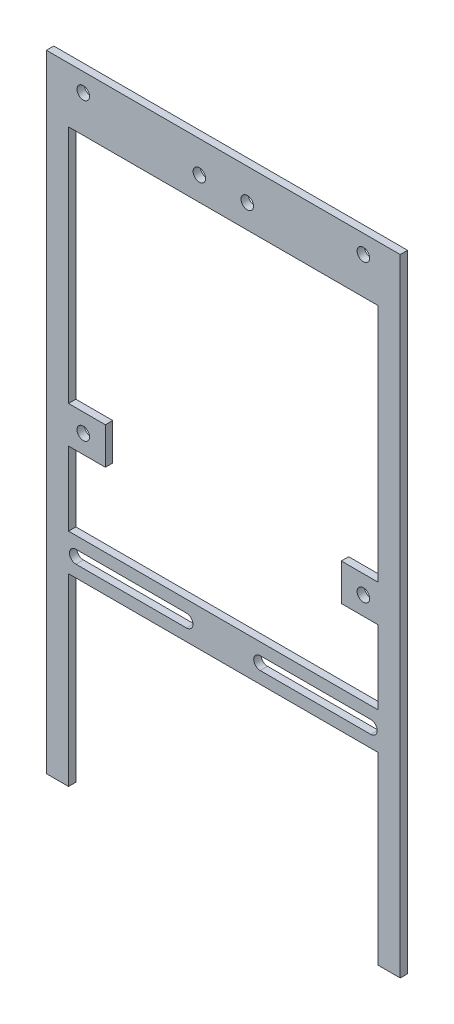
SolidWorks part; units mm, degrees
ref_plane "前视基准面" through (0, 0, 0) normal (0, 0, 1) x (1, 0, 0)
ref_plane "上视基准面" through (0, 0, 0) normal (0, 1, 0) x (1, 0, 0)
ref_plane "右视基准面" through (0, 0, 0) normal (1, 0, 0) x (0, 0, -1)
sketch "草图1" plane through (0, 0, 0) normal (0, 0, 1) x (1, 0, 0)
  line L1 (-47, 85) -> (47, 85)
  line L2 (-47, 85) -> (-47, -85)
  line L3 (-47, -85) -> (47, -85)
  line L4 (47, 85) -> (47, -85)
  line L5 (-47, 85) -> (47, -85) construction
  line L6 (-47, -85) -> (47, 85) construction
  point P0 (0, 0)
  dimension "D1" = 94
  dimension "D2" = 170
extrude "凸台-拉伸1" add sketch "草图1" along normal blind 2
hole_wizard "Ø3.4 (3.4) 直径孔1" positions "草图2" profile "草图3" hole size "Ø3.4" standard "GB"
sketch "草图2" plane through (0, 0, 2) normal (0, 0, 1) x (1, 0, 0)
  point P0 (-6.5, 76.4436)
  point P3 (6.5, 76.4436)
sketch "草图3" plane through (-6.5, 76.4436, 2) normal (1, 0, 0) x (0, -1, 0)
  line L0 (0, 0) -> (0, 2)
  line L1 (0, 2) -> (1.7, 2)
  line L2 (1.7, 2) -> (1.7, 0)
  line L5 (1.7, 0) -> (0, 0)
  line L11 (0, -6.35) -> (0, 107.95) construction
  dimension "通孔孔直径" = 3.4
  dimension "通孔孔深度" = 2
hole_wizard "Ø3.4 (3.4) 直径孔2" positions "草图4" profile "草图5" hole size "Ø3.4" standard "GB"
sketch "草图4" plane through (0, 0, 2) normal (0, 0, 1) x (1, 0, 0)
  point P0 (-38, 80)
  point P3 (38, 80)
  point P7 (-38, 0)
  point P10 (38, 0)
sketch "草图5" plane through (-38, 80, 2) normal (1, 0, 0) x (0, -1, 0)
  line L0 (0, 0) -> (0, 2)
  line L1 (0, 2) -> (1.7, 2)
  line L2 (1.7, 2) -> (1.7, 0)
  line L5 (1.7, 0) -> (0, 0)
  line L11 (0, -6.35) -> (0, 107.95) construction
  dimension "通孔孔直径" = 3.4
  dimension "通孔孔深度" = 2
sketch "草图6" plane through (0, 0, 2) normal (0, 0, 1) x (1, 0, 0)
  line L0 (-47, -85) -> (47, -85) construction
  line L1 (-32, -85) -> (32, -85)
  line L2 (32, 5) -> (42, 5)
  line L3 (-42, -5) -> (-32, -5)
  line L4 (-42, -5) -> (-42, -25)
  line L5 (47, 85) -> (-47, 85) construction
  line L6 (-32, 70) -> (32, 70)
  line L7 (-32, 5) -> (-32, -5)
  line L9 (32, 5) -> (32, -5)
  line L10 (47, -85) -> (47, 85) construction
  line L11 (-47, 85) -> (-47, -85) construction
  line L12 (-42, -25) -> (42, -25)
  line L13 (42, -5) -> (42, -25)
  line L14 (-42, -85) -> (42, -85)
  line L15 (-42, -35) -> (42, -35)
  line L16 (-42, -35) -> (-42, -85)
  line L17 (-42, -85) -> (42, -85)
  line L18 (42, -35) -> (42, -85)
  line L19 (-42, -72.1814) -> (-47, -72.1814)
  line L20 (-42, -72.1814) -> (-42, -73.2865)
  line L21 (-42, -73.2865) -> (-47, -73.2865)
  line L22 (-47, -72.1814) -> (-47, -73.2865)
  line L23 (-42, 70) -> (42, 70)
  line L24 (-42, 70) -> (-42, 5)
  line L25 (-42, 5) -> (-32, 5)
  line L26 (42, 70) -> (42, 5)
  line L27 (32, -5) -> (42, -5)
  dimension "D1" = 15
  dimension "D2" = 15
  dimension "D3" = 15
  dimension "D4" = 20
  dimension "D5" = 5
  dimension "D6" = 5
  dimension "D8" = 60
  dimension "D9" = 5
  dimension "D10" = 5
  dimension "D11" = 10
  dimension "D12" = 10
  dimension "D13" = 0
  dimension "D14" = 5
  dimension "D15" = 5
extrude "切除-拉伸1" cut sketch "草图6" against normal up to next contours L27 L9 L2 L26 L23 L6 L24 L25 L7 L3 L4 L12 L13 | L18 L15 L16 M16
sketch "草图8" plane through (47, 0, 0) normal (1, 0, 0) x (0, 0, -1)
  line L4 (0, -85) -> (0, 85)
  line L5 (0, 85) -> (-2, 85)
  line L6 (-2, 85) -> (-2, -85)
  line L7 (-2, -85) -> (0, -85)
  line L8 (0, -85) -> (0, 85)
  line L9 (0, 85) -> (-2, 85)
  line L10 (-2, 85) -> (-2, -85)
  line L11 (-2, -85) -> (0, -85)
  dimension "D1" = 0
extrude "凸台-拉伸2" add sketch "草图8" along normal blind 1
sketch "草图9" plane through (-47, 0, 0) normal (-1, 0, 0) x (0, 0, 1)
  line L4 (0, 85) -> (0, -85)
  line L5 (0, -85) -> (2, -85)
  line L6 (2, -85) -> (2, 85)
  line L7 (2, 85) -> (0, 85)
  line L8 (0, 85) -> (0, -85)
  line L9 (0, -85) -> (2, -85)
  line L10 (2, -85) -> (2, 85)
  line L11 (2, 85) -> (0, 85)
  dimension "D1" = 0
extrude "凸台-拉伸3" add sketch "草图9" along normal blind 1
sketch "草图10" plane through (0, 0, 2) normal (0, 0, 1) x (1, 0, 0)
  line L0 (-40, -30) -> (-10, -30) construction
  line L1 (-40, -28.25) -> (-10, -28.25)
  line L2 (-40, -31.75) -> (-10, -31.75)
  line L3 (10, -30) -> (40, -30) construction
  line L4 (10, -28.25) -> (40, -28.25)
  line L5 (10, -31.75) -> (40, -31.75)
  line L6 (-48, -85) -> (-48, 85) construction
  line L7 (48, 85) -> (48, -85) construction
  line L8 (-42, -35) -> (42, -35) construction
  arc A0 (-40, -28.25) -> (-40, -31.75) centre (-40, -30) ccw
  arc A1 (-10, -31.75) -> (-10, -28.25) centre (-10, -30) ccw
  arc A2 (10, -28.25) -> (10, -31.75) centre (10, -30) ccw
  arc A3 (40, -31.75) -> (40, -28.25) centre (40, -30) ccw
  point P2 (-25, -30)
  point P7 (25, -30)
  dimension "D7" = 1.75
  dimension "D8" = 1.75
  dimension "D1" = 8
  dimension "D2" = 8
  dimension "D3" = 30
  dimension "D4" = 30
  dimension "D5" = 5
  dimension "D6" = 5
extrude "切除-拉伸2" cut sketch "草图10" against normal up to next
